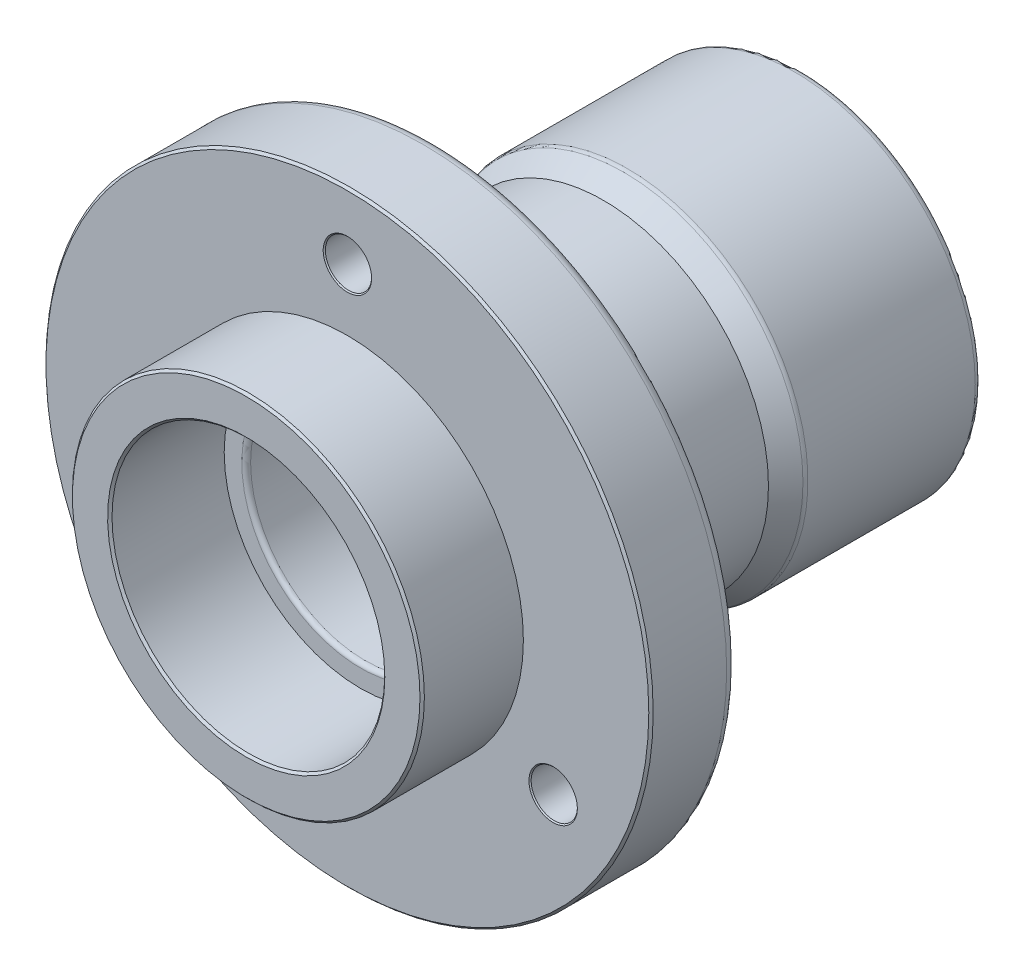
SolidWorks part; units mm, degrees
ref_plane "Plan de face" through (0, 0, 0) normal (0, 0, 1) x (1, 0, 0)
ref_plane "Plan de dessus" through (0, 0, 0) normal (0, 1, 0) x (1, 0, 0)
ref_plane "Plan de droite" through (0, 0, 0) normal (1, 0, 0) x (0, 0, -1)
sketch "Esquisse1" plane through (0, 0, 0) normal (0, 0, 1) x (1, 0, 0)
  circle A0 centre (0, 0) radius 41
  dimension "D1" = 82
extrude "Extrusion1" add sketch "Esquisse1" along normal blind 40
sketch "Esquisse9" plane through (0, 0, 0) normal (0, 1, 0) x (1, 0, 0)
  line L0 (-41, -40) -> (-37.5, -45)
  line L1 (0, -26.0631) -> (0, -51.0805) construction
  line L2 (-37.5, -45) -> (0, -45)
  line L3 (-41, -40) -> (0, -40)
  line L4 (-41, -40) -> (41, -40) construction
  line L5 (0, -45) -> (0, -40)
  dimension "D1" = 75
  dimension "D2" = 5
revolve "Révolution4" add sketch "Esquisse9" angle 360 about L1
sketch "Esquisse12" plane through (0, 0, 45) normal (0, 0, 1) x (1, 0, 0)
  circle A0 centre (0, 0) radius 37.5
  circle A1 centre (0, 0) radius 37.5 construction
extrude "Extrusion2" add sketch "Esquisse12" along normal blind 35
sketch "Esquisse16" plane through (0, 0, 0) normal (0, 1, 0) x (1, 0, 0)
  line L0 (0, -59.6194) -> (0, -92.0016) construction
  line L1 (-40.5, -80) -> (0, -80)
  line L2 (-40.5, -80) -> (-43.5, -83.5)
  line L3 (-43.5, -83.5) -> (0, -83.5)
  line L4 (-37.5, -80) -> (37.5, -80) construction
  line L6 (0, -80) -> (0, -83.5)
  dimension "D1" = 87
  dimension "D2" = 81
  dimension "D3" = 3.5
revolve "Révolution5" add sketch "Esquisse16" angle 360 about L0
sketch "Esquisse17" plane through (0, 0, 83.5) normal (0, 0, 1) x (1, 0, 0)
  circle A0 centre (0, 0) radius 69
  dimension "D1" = 138
extrude "Extrusion3" add sketch "Esquisse17" along normal blind 19.7
sketch "Esquisse18" plane through (0, 0, 103.2) normal (0, 0, 1) x (1, 0, 0)
  circle A0 centre (0, 0) radius 40
  dimension "D1" = 80
extrude "Extrusion4" add sketch "Esquisse18" along normal blind 23
sketch "Esquisse19" plane through (0, 0, 0) normal (1, 0, 0) x (0, 0, -1)
  line L0 (26.171, 0) -> (-152.5124, 0) construction
  line L1 (-126.2, 0) -> (-126.2, 31)
  line L2 (-126.2, 40) -> (-126.2, -40) construction
  line L7 (-126.2, 31) -> (-100.2, 31)
  line L8 (-100.2, 31) -> (-100.2, 26)
  line L9 (-100.2, 26) -> (-31, 26)
  line L10 (-31, 26) -> (-31, 31)
  line L11 (-31, 31) -> (0, 31)
  line L15 (0, -41) -> (0, 41) construction
  line L16 (0, 31) -> (0, 0)
  line L18 (-126.2, 0) -> (0, 0)
  dimension "D1" = 62
  dimension "D2" = 31
  dimension "D3" = 26
  dimension "D4" = 52
revolve "Enlèvement de matière-Révolution1" cut sketch "Esquisse19" angle 360 about L0
sketch "Esquisse20" plane through (0, 0, 83.5) normal (0, 0, 1) x (1, 0, 0)
  line L0 (0, 0) -> (0, 69) construction
  circle A0 centre (0, 54) radius 5.25
  circle A1 centre (0, 0) radius 54 construction
  circle A3 centre (0, 0) radius 69 construction
  dimension "D3" = 10.5
  dimension "D1" = 108
extrude "Enlèv. mat.-Extru.1" cut sketch "Esquisse20" along normal through all
chamfer "Chanfrein4" distance 0.25 angle 45 2 edges at (5.25, 54, 83.5) (5.25, 54, 103.2)
pattern_circular "Répétition circulaire1" count 3 over 360 about axis through (0, 0, 0) along (0, 0, 1) of "Enlèv. mat.-Extru.1", "Chanfrein4"
fillet "Congé1" radius 1.5 1 edges at (41, 0, 0)
fillet "Congé2" radius 1.5 1 edges at (41, 0, 40)
fillet "Congé5" radius 1 2 edges at (0, 26, 31) (0, 26, 100.2)
fillet "Congé7" radius 2.5 1 edges at (69, 0, 83.5)
ref_plane "Plan1" through (0, 0, -26.171) normal (-1, 0, 0) x (0, 1, 0)
ref_plane "Plan2" through (0, 0, -26.171) normal (-1, 0, 0) x (0, 1, 0)
sketch "Esquisse24" plane through (0, 0, -26.171) normal (-1, 0, 0) x (0, 1, 0)
  line L0 (32.285, -40.321) -> (31, -40.321)
  line L1 (31, -40.321) -> (31, -38.171)
  line L2 (31, -38.171) -> (32.285, -38.171)
  line L3 (32.5, -38.386) -> (32.5, -40.106)
  line L4 (0, -49.7362) -> (0, 49.6401) construction
  line L5 (31, -57.171) -> (-31, -57.171) construction
  line L6 (31, -57.171) -> (31, -26.171) construction
  arc A0 (32.5, -40.106) -> (32.285, -40.321) centre (32.285, -40.106) cw
  arc A1 (32.5, -38.386) -> (32.285, -38.171) centre (32.285, -38.386) ccw
  dimension "D1" = 0.215
  dimension "D2" = 0.215
  dimension "D3" = 2.15
  dimension "D4" = 19
  dimension "D5" = 65
revolve "Gorge pour DIN 472 - 62 x 2, Circlips extérieur - normal2" cut sketch "Esquisse24"
sketch "Esquisse25" plane through (0, 0, 0) normal (0, 0, -1) x (-1, 0, 0)
  circle A0 centre (0, 0) radius 36
  dimension "D1" = 72
extrude "Extrusion5" cut sketch "Esquisse25" against normal blind 10
chamfer "Chanfrein1" distance 0.5 angle 45 4 edges at (69, 0, 103.2) (40, 0, 126.2) (0, 31, 126.2) (-36, 0, 0)
